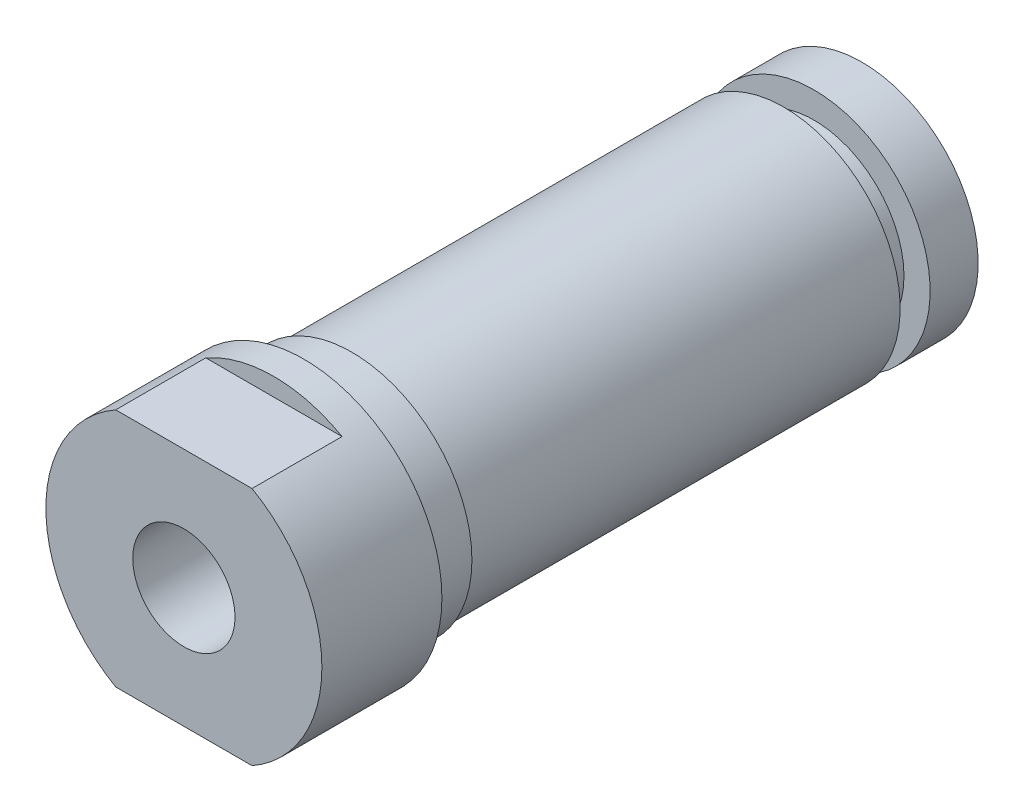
SolidWorks part; units mm, degrees
ref_plane "Front Plane" through (0, 0, 0) normal (0, 0, 1) x (1, 0, 0)
ref_plane "Top Plane" through (0, 0, 0) normal (0, 1, 0) x (1, 0, 0)
ref_plane "Right Plane" through (0, 0, 0) normal (1, 0, 0) x (0, 0, -1)
sketch "Sketch1" plane through (0, 0, 0) normal (0, 0, 1) x (1, 0, 0)
  circle A0 centre (0, 0) radius 7.3025
  dimension "D1" = 14.605
extrude "Extrude1" add sketch "Sketch1" against normal blind 6.35
sketch "Sketch2" plane through (0, 0, -6.35) normal (0, 0, -1) x (-1, 0, 0)
  circle A0 centre (0, 0) radius 6.35
  dimension "D1" = 12.7
extrude "Extrude2" add sketch "Sketch2" along normal blind 2.54
sketch "Sketch3" plane through (0, 0, -8.89) normal (0, 0, -1) x (-1, 0, 0)
  circle A0 centre (0, 0) radius 6.1468
  dimension "D1" = 12.2936
extrude "Extrude3" add sketch "Sketch3" along normal blind 22.86
sketch "Sketch4" plane through (0, 0, -31.75) normal (0, 0, -1) x (-1, 0, 0)
  circle A0 centre (0, 0) radius 4.7625
  dimension "D1" = 9.525
extrude "Extrude4" add sketch "Sketch4" along normal blind 1.5875
sketch "Sketch5" plane through (0, 0, -33.3375) normal (0, 0, -1) x (-1, 0, 0)
  circle A0 centre (0, 0) radius 6.1468
  dimension "D1" = 12.2936
extrude "Extrude5" add sketch "Sketch5" along normal blind 2.54
hole_wizard "1/4-28 Tapped Hole1" positions "3DSketch1" profile "Sketch7" tap size "1/4-28" standard "Ansi Inch"
sketch3d "3DSketch1"
  line L0 (0, 0, -35.8775) -> (0, 0, -33.3375) construction
  point P24 (0, 0, -35.8775)
sketch "Sketch7" plane through (0, 0, -35.8775) normal (1, 0, 0) x (0, 1, 0)
  line L0 (0, 0) -> (0, 35.8775)
  line L1 (0, 35.8775) -> (2.7051, 35.8775)
  line L2 (2.7051, 35.8775) -> (2.7051, 0)
  line L5 (2.7051, 0) -> (0, 0)
  line L11 (0, -6.35) -> (0, 107.95) construction
  dimension "Thru Tap Drill Dia." = 5.4102
  dimension "Thru Tap Drill Depth" = 35.8775
sketch "Sketch8" plane through (0, 0, 0) normal (1, 0, 0) x (0, 0, -1)
  line L0 (-2.2303, 0) -> (30.5102, 0) construction
  line L1 (0, 7.3025) -> (4.7625, 7.3025)
  line L2 (0, 7.3025) -> (0, 6.35)
  line L3 (0, 6.35) -> (4.7625, 6.35)
  line L4 (4.7625, 7.3025) -> (4.7625, 6.35)
  line L5 (4.7625, -7.3025) -> (4.7625, -6.35)
  line L6 (0, -6.35) -> (4.7625, -6.35)
  line L7 (0, -7.3025) -> (0, -6.35)
  line L8 (0, -7.3025) -> (4.7625, -7.3025)
  line L9 (6.35, -7.3025) -> (6.35, 7.3025) construction
  dimension "D1" = 12.7
  dimension "D2" = 1.5875
extrude "Cut-Extrude1" cut sketch "Sketch8" against normal mid plane 25.4
